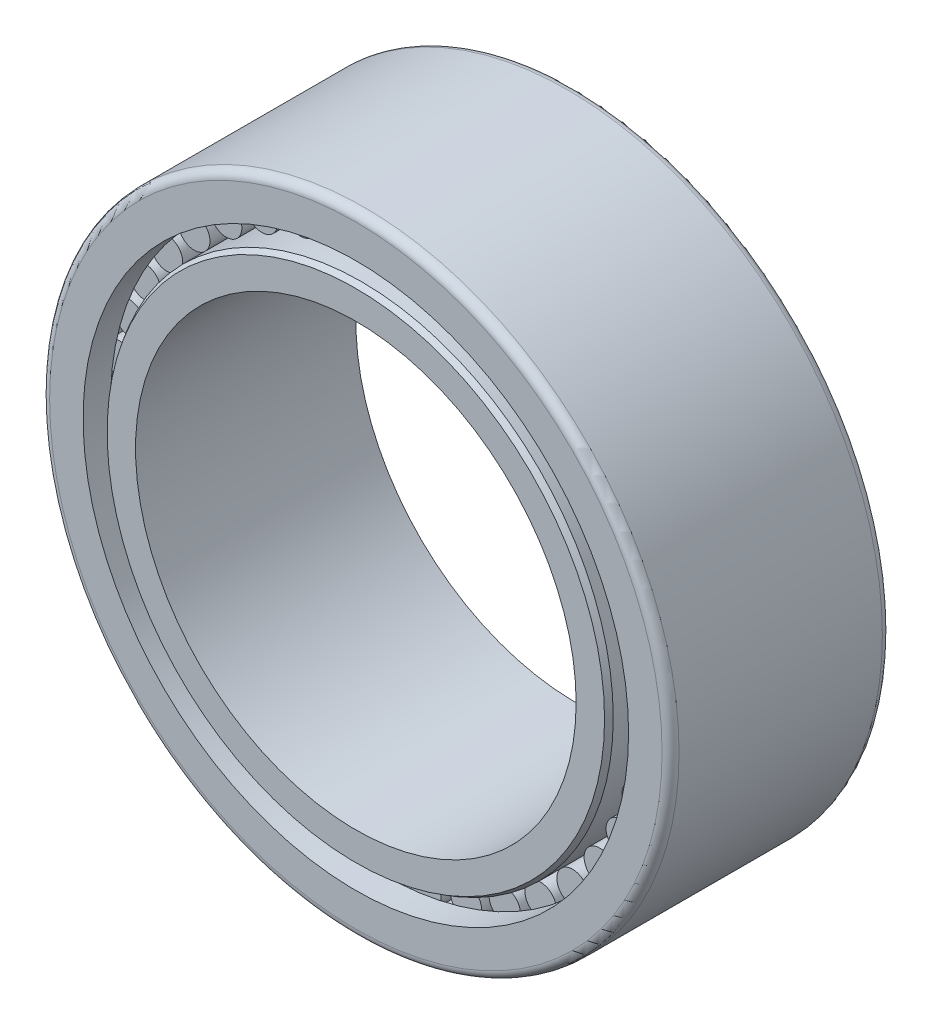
SolidWorks part; units mm, degrees
ref_plane "Front Plane" through (0, 0, 0) normal (0, 0, 1) x (1, 0, 0)
ref_plane "Top Plane" through (0, 0, 0) normal (0, 1, 0) x (1, 0, 0)
ref_plane "Right Plane" through (0, 0, 0) normal (1, 0, 0) x (0, 0, -1)
sketch "BaseSke" plane through (0, 0, 0) normal (1, 0, 0) x (0, 0, -1)
  line L0 (-47.2296, 0) -> (24.6132, 0) construction
  line L1 (-47.2296, 42.5) -> (24.6132, 42.5) construction
  line L2 (0, 129.5214) -> (0, -86.3012) construction
  line L3 (-13.125, 42.5) -> (-13.125, 45) construction
  line L4 (-17.5, 50) -> (17.5, 50) construction
  line L5 (-17.5, 35) -> (17.5, 35) construction
  line L6 (-13.125, 40) -> (13.125, 40)
  line L7 (-13.125, 40) -> (-13.125, 42.5)
  line L8 (-13.125, 42.5) -> (13.125, 42.5)
  line L9 (13.125, 40) -> (13.125, 42.5)
  line L10 (-13.125, 45) -> (13.125, 45) construction
  line L11 (13.125, 45) -> (13.125, 42.5) construction
  dimension "D2" = 26.25
  dimension "D1" = 85
  dimension "Bearing_Thickness" = 35
  dimension "Bearing_Outside_Diameter" = 100
  dimension "Bearing_Inside_Diameter" = 70
  dimension "Diameter_Fw" = 80
revolve "Roller" add sketch "BaseSke" angle 360 about L8
sketch "OuterRaceSke" plane through (0, 0, 0) normal (1, 0, 0) x (0, 0, -1)
  line L0 (0, 0) -> (0, 87.5396) construction
  line L1 (-17.5, 50) -> (17.5, 50)
  line L2 (-17.5, 50) -> (-17.5, 43.3333)
  line L3 (-17.5, 43.3333) -> (-13.15, 43.3333)
  line L4 (17.5, 50) -> (17.5, 43.3333)
  line L5 (-50.3916, 0) -> (55.2197, 0) construction
  line L6 (-13.125, 45) -> (13.125, 45) construction
  line L7 (13.15, 43.3333) -> (17.5, 43.3333)
  line L9 (-13.15, 43.3333) -> (-13.15, 44.98)
  line L10 (-13.15, 44.98) -> (13.15, 44.98)
  line L11 (13.15, 43.3333) -> (13.15, 44.98)
  dimension "D1" = 26.3
  dimension "D2" = 86.6667
  dimension "D3" = 0.02
revolve "OuterRace" add sketch "OuterRaceSke" angle 360 about L5
sketch "InnerRaceSke" plane through (0, 0, 0) normal (1, 0, 0) x (0, 0, -1)
  line L0 (-70.8626, 0) -> (113.5527, 0) construction
  line L1 (0, 58.441) -> (0, -70.8113) construction
  line L2 (-17.5, 35) -> (17.5, 35)
  line L3 (-17.5, 35) -> (-17.5, 39.5148)
  line L5 (-16.625, 40.02) -> (-17.5, 39.5148)
  line L6 (0, 129.5214) -> (0, -86.3012) construction
  line L7 (-16.625, 40.02) -> (16.625, 40.02)
  line L9 (17.5, 35) -> (17.5, 39.5148)
  line L10 (16.625, 40.02) -> (17.5, 39.5148)
  line L13 (-13.125, 40) -> (13.125, 40) construction
  point P17 (0, 35)
  dimension "D2" = 0.02
  dimension "D1" = 33.25
  dimension "D3" = 30
revolve "InnerRace" add sketch "InnerRaceSke" angle 360 about L0
fillet "Fillet1" radius 1.35 2 edges at (50, 0, -17.5) (50, 0, 17.5)
pattern_circular "CirPatternBall" count 40 over 360 about axis through (0, 0, 0) along (0, 0, 1) of "Roller"
sketch "SimplifiedSke" plane through (0, 0, 0) normal (1, 0, 0) x (0, 0, -1)
  line L0 (37.5911, 0) -> (-37.5911, 0) construction
  line L1 (-13.1351, 42.5) -> (13.151, 42.5) construction
  line L2 (-13.125, 45) -> (13.125, 45)
  line L3 (-13.125, 45) -> (-13.125, 40)
  line L4 (-13.125, 40) -> (13.125, 40)
  line L5 (13.125, 45) -> (13.125, 40)
  line L6 (-47.2296, 42.5) -> (24.6132, 42.5) construction
revolve "Simplified" [suppressed] add sketch "SimplifiedSke" angle 360 about L0
equation "\"D2@BaseSke\" = \"Bearing_Thickness@BaseSke\"*0.75"
equation "\"D1@BaseSke\" =  ( \"Bearing_Outside_Diameter@BaseSke\" + \"Bearing_Inside_Diameter@BaseSke\" )  / 2"
equation "\"D1@OuterRaceSke\" = \"Bearing_Thickness@BaseSke\"*0.75+0.05"
equation "\"D2@OuterRaceSke\" =  \"D1@BaseSke\" + ( \"D1@BaseSke\" - \"Diameter_Fw@BaseSke\" )  /3"
equation "\"D1@InnerRaceSke\" = \"Bearing_Thickness@BaseSke\"*0.95"
equation "\"D1@CirPatternBall\" =  int(  ( \"Bearing_Outside_Diameter@BaseSke\" + \"Bearing_Inside_Diameter@BaseSke\" )  / 2 *  pi  /  ( \"Bearing_Outside_Diameter@BaseSke\" - \"Bearing_Inside_Diameter@BaseSke\" ) * 4.5 "
